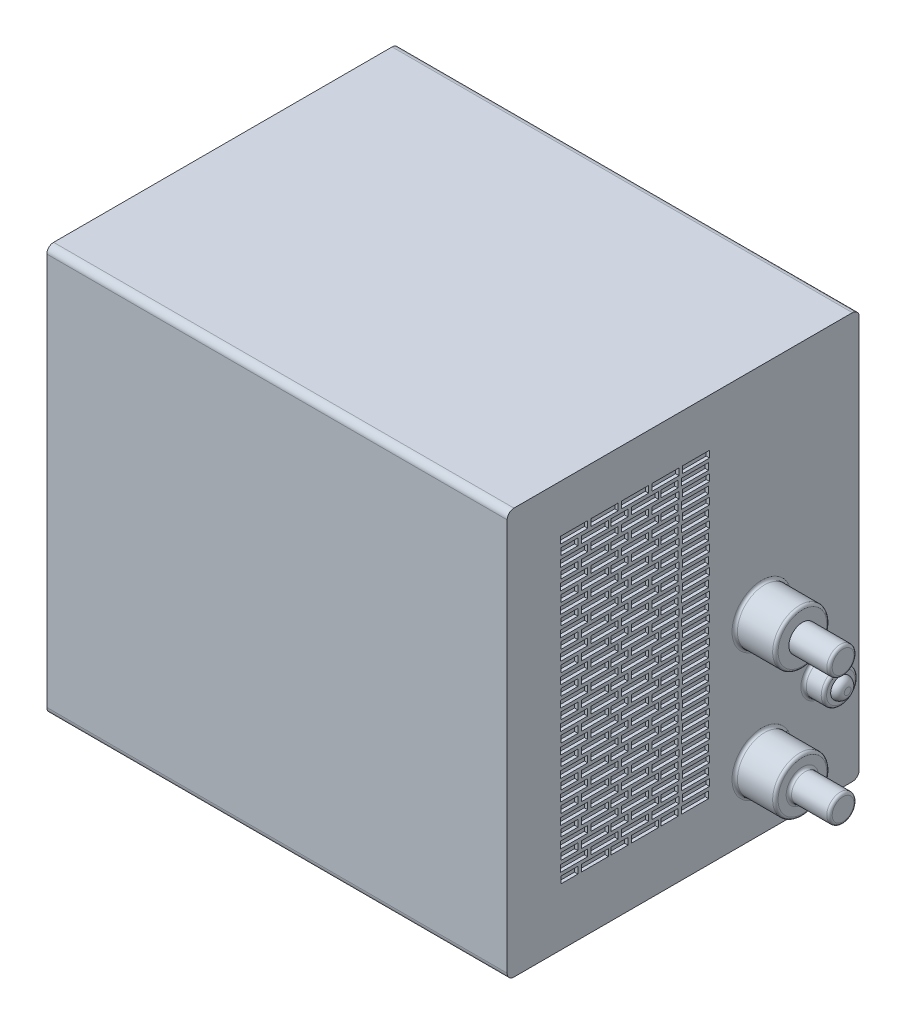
SolidWorks part; units mm, degrees
ref_plane "Bottom Plane" through (0, 0, 0) normal (0, 0, 1) x (1, 0, 0)
ref_plane "Front Plane" through (0, 0, 0) normal (0, 1, 0) x (1, 0, 0)
ref_plane "Left Plane" through (0, 0, 0) normal (1, 0, 0) x (0, 0, -1)
ref_plane "Right Plane" through (431.8, 0, 0) normal (1, 0, 0) x (0, 0, -1)
ref_plane "Back Plane" through (0, 381, 0) normal (0, 1, 0) x (1, 0, 0)
ref_plane "Top Plane" through (0, 0, 330.2) normal (0, 0, 1) x (1, 0, 0)
sketch "Sketch2" plane through (0, 0, 0) normal (1, 0, 0) x (0, 0, -1)
  line L0 (83.82, 381) -> (-83.82, 381) construction
  line L1 (0, 0) -> (-330.2, 0)
  line L2 (0, 0) -> (0, 381)
  line L3 (0, 381) -> (-330.2, 381)
  line L4 (-330.2, 0) -> (-330.2, 381)
  line L5 (-330.2, 55) -> (-330.2, -55) construction
extrude "Boss-Extrude1" add sketch "Sketch2" along normal up to surface (431.8 mm away)
ref_plane "half length" through (215.9, 0, 0) normal (1, 0, 0) x (0, 0, -1)
ref_plane "Half Height" through (0, 0, 165.1) normal (0, 0, 1) x (1, 0, 0)
fillet "Fillet1" radius 6.35 4 edges at (215.9, 381, 330.2) (215.9, 381, 0) (215.9, 0, 0) (215.9, 0, 330.2)
extrude "Cut-Extrude5" cut sketch "Sketch7" against normal through all and the other way through all
sketch "Sketch7" [suppressed] plane through (0, 0, 0) normal (0, 1, 0) x (0, 0, 1)
  line L2 (44.45, 177.8) -> (44.45, 47.752) construction
  circle A0 centre (44.45, 47.752) radius 4.7625
  circle A1 centre (44.45, 177.8) radius 4.7625
  circle A2 centre (44.45, 112.776) radius 4.7625
ref_plane "Half Depth" through (0, 190.5, 0) normal (0, 1, 0) x (1, 0, 0)
sketch "Sketch8" plane through (0, 0, 0) normal (0, 0, -1) x (-1, 0, 0)
  line L0 (-292.1, 304.8) -> (-139.7, 304.8) construction
  line L1 (-292.1, 330.2) -> (-139.7, 330.2)
  line L2 (-292.1, 279.4) -> (-139.7, 279.4)
  line L3 (0, 374.65) -> (-431.8, 374.65) construction
  line L4 (-431.8, 381) -> (0, 381) construction
  arc A0 (-292.1, 330.2) -> (-292.1, 279.4) centre (-292.1, 304.8) ccw
  arc A1 (-139.7, 279.4) -> (-139.7, 330.2) centre (-139.7, 304.8) ccw
  point P2 (-215.9, 304.8)
  point P10 (-215.9, 374.65)
  dimension "D3" = 152.4
  dimension "D1" = 50.8
  dimension "D2" = 50.8
extrude "Cut-Extrude6" cut sketch "Sketch8" against normal blind 3.175
sketch "Sketch9" plane through (0, 0, 3.175) normal (0, 0, -1) x (-1, 0, 0)
  line L1 (-284.0153, 317.4851) -> (-219.485, 317.4851)
  line L2 (-284.0153, 317.4851) -> (-284.0153, 292.5787)
  line L3 (-284.0153, 292.5787) -> (-219.485, 292.5787)
  line L4 (-219.485, 317.4851) -> (-219.485, 292.5787)
  line L5 (-195.3333, 319.8099) -> (-182.4843, 319.8099)
  line L6 (-195.3333, 319.8099) -> (-195.3333, 306.9609)
  line L7 (-195.3333, 306.9609) -> (-182.4843, 306.9609)
  line L8 (-182.4843, 319.8099) -> (-182.4843, 306.9609)
  line L9 (-195.3333, 305.0319) -> (-182.5027, 305.0319)
  line L10 (-195.3333, 305.0319) -> (-195.3333, 292.5787)
  line L11 (-195.3333, 292.5787) -> (-182.5027, 292.5787)
  line L12 (-182.5027, 305.0319) -> (-182.5027, 292.5787)
  line L13 (-169.6721, 305.0319) -> (-156.0868, 305.0319)
  line L14 (-169.6721, 305.0319) -> (-169.6721, 292.5787)
  line L15 (-169.6721, 292.5787) -> (-156.0868, 292.5787)
  line L16 (-156.0868, 305.0319) -> (-156.0868, 292.5787)
  point P16 (-182.4843, 319.8099)
extrude "Boss-Extrude2" add sketch "Sketch9" along normal blind 2.54
sketch "Sketch11" plane through (0, 0, 0.635) normal (0, 0, -1) x (-1, 0, 0)
  ellipse E0 centre (-137.0073, 299.8728) end of major axis (-126.9745, 299.4046) minor radius 7.373
  point P1 (0, 0)
  point P7 (-141.5388, 299.7139)
  point P8 (-154.1356, 299.8728)
  point P9 (-137.0073, 299.8728)
  point P10 (-147.0402, 300.3411)
extrude "Boss-Extrude3" add sketch "Sketch11" against normal up to vertex
sketch "Sketch12" plane through (431.8, 0, 0) normal (1, 0, 0) x (0, 0, -1)
  line L1 (-280.0093, 336.2443) -> (-254.6093, 336.2443)
  line L2 (-280.0093, 336.2443) -> (-280.0093, 329.8943)
  line L3 (-280.0093, 329.8943) -> (-254.6093, 329.8943)
  line L4 (-254.6093, 336.2443) -> (-254.6093, 329.8943)
  dimension "D1" = 25.4
  dimension "D2" = 6.35
extrude "Cut-Extrude7" cut sketch "Sketch12" against normal blind 3.175
pattern_linear "LPattern1" count 5 spacing 28.575 along (0, 0, -1) of "Cut-Extrude7"
sketch "Sketch13" plane through (431.8, 0, 0) normal (1, 0, 0) x (0, 0, -1)
  line L0 (-280.0093, 329.8943) -> (-254.6093, 329.8943) construction
  line L1 (-279.6956, 326.7193) -> (-263.8206, 326.7193)
  line L2 (-279.6956, 326.7193) -> (-279.6956, 320.3693)
  line L3 (-279.6956, 320.3693) -> (-263.8206, 320.3693)
  line L4 (-263.8206, 326.7193) -> (-263.8206, 320.3693)
  line L6 (-260.6456, 326.7193) -> (-235.2456, 326.7193)
  line L7 (-260.6456, 326.7193) -> (-260.6456, 320.3693)
  line L8 (-260.6456, 320.3693) -> (-235.2456, 320.3693)
  line L9 (-235.2456, 326.7193) -> (-235.2456, 320.3693)
  dimension "D1" = 6.35
  dimension "D2" = 3.175
  dimension "D3" = 15.875
  dimension "D4" = 25.4
  dimension "D5" = 3.175
  dimension "D6" = 6.35
extrude "Cut-Extrude8" cut sketch "Sketch13" against normal blind 3.175
pattern_linear "LPattern2" count 3 spacing 46.99 along (0, 0, -1) of "Cut-Extrude8"
pattern_linear "LPattern3" count 15 spacing 19.05 along (0, -1, 0) of "LPattern1", "LPattern2", "Cut-Extrude7", "Cut-Extrude8"
sketch "Sketch14" plane through (431.8, 0, 0) normal (1, 0, 0) x (0, 0, -1)
  circle A0 centre (-91.3241, 58.2317) radius 25.4
  circle A1 centre (-91.3241, 178.2355) radius 25.4
  point P4 (0, 0)
  point P5 (-91.3241, 58.2317)
  dimension "D1" = 50.8
  dimension "D2" = 50.8
extrude "Boss-Extrude5" add sketch "Sketch14" along normal blind 38.1
sketch "Sketch15" plane through (469.9, 0, 0) normal (1, 0, 0) x (0, 0, -1)
  circle A0 centre (-91.3241, 178.2355) radius 12.7
  circle A1 centre (-91.3241, 58.2317) radius 12.7
  dimension "D1" = 25.4
  dimension "D2" = 25.4
extrude "Boss-Extrude6" add sketch "Sketch15" along normal blind 38.1
fillet "Fillet2" radius 2.54 7 edges at (431.8, 58.2317, 65.9241) (469.9, 58.2317, 78.6241) (469.9, 58.2317, 65.9241) (508, 58.2317, 78.6241) (508, 178.2355, 78.6241) (431.8, 178.2355, 65.9241) (469.9, 178.2355, 65.9241)
sketch "Sketch16" plane through (431.8, 0, 0) normal (1, 0, 0) x (0, 0, -1)
  circle A0 centre (-36.221, 101.0394) radius 15.875
  point P2 (-36.221, 101.0394)
  dimension "D1" = 31.75
extrude "Boss-Extrude7" add sketch "Sketch16" along normal blind 19.05
sketch "Sketch17" plane through (450.85, 0, 0) normal (1, 0, 0) x (0, 0, -1)
  circle A0 centre (-36.221, 101.0394) radius 9.525
  dimension "D1" = 19.05
extrude "Boss-Extrude8" add sketch "Sketch17" along normal blind 6.35
fillet "Fillet3" radius 6.35 1 edges at (457.2, 101.0394, 26.696)
fillet "Fillet4" radius 2.54 2 edges at (450.85, 101.0394, 20.346) (431.8, 101.0394, 20.346)
